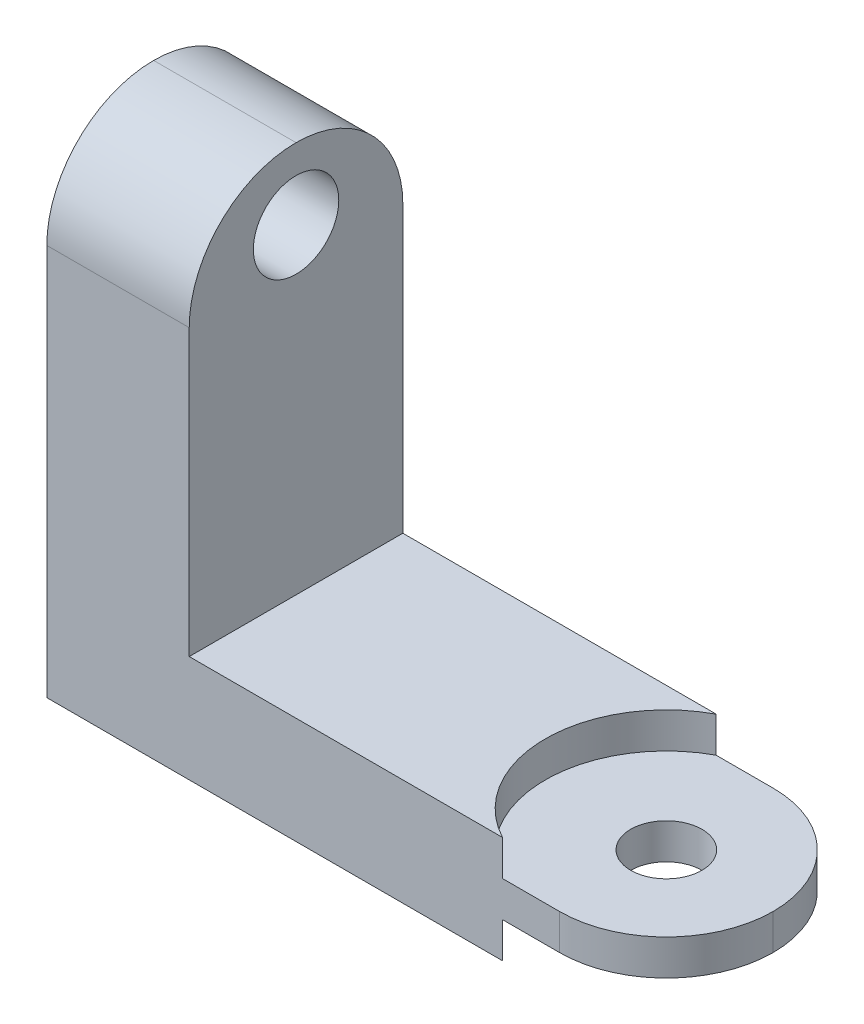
SolidWorks part; units mm, degrees
ref_plane "Plan 1" through (0, 0, 0) normal (0, 0, 1) x (1, 0, 0)
ref_plane "Plan 2" through (0, 0, 0) normal (0, 1, 0) x (1, 0, 0)
ref_plane "Plan 3" through (0, 0, 0) normal (1, 0, 0) x (0, 0, -1)
sketch "Esquisse1" plane through (0, 0, 0) normal (0, 0, 1) x (1, 0, 0)
  line L0 (0, 0) -> (87, 0)
  line L1 (87, 0) -> (87, 15)
  line L2 (87, 15) -> (20, 15)
  line L3 (20, 15) -> (20, 70)
  line L4 (20, 70) -> (0, 70)
  line L5 (0, 70) -> (0, 0)
  dimension "D1" = 70
  dimension "D2" = 87
  dimension "D3" = 20
  dimension "D4" = 15
extrude "Base-Extrusion" add sketch "Esquisse1" along normal blind 30
fillet "Congé1" radius 15 4 edges at (87, 7.5, 30) (87, 15, 15) (87, 0, 15) (87, 7.5, 0)
sketch "Esquisse2" plane through (20, 0, 0) normal (1, 0, 0) x (0, 0, -1)
  line L0 (-15, 70) -> (-15, 50) construction
  line L1 (-30, 70) -> (0, 70) construction
  circle A0 centre (-15, 60) radius 6
  dimension "D1" = 12
  dimension "D2" = 10
extrude "Enlèv. mat.-Extru.1" cut sketch "Esquisse2" against normal through all
sketch "Esquisse3" plane through (0, 15, 0) normal (0, 1, 0) x (-1, 0, 0)
  circle A0 centre (-72, 15) radius 5
  arc A1 (-87, 15) -> (-72, 0) centre (-72, 15) ccw construction
  dimension "D1" = 10
extrude "Enlèv. mat.-Extru.3" cut sketch "Esquisse3" against normal through all
sketch "Esquisse4" plane through (0, 15, 0) normal (0, 1, 0) x (-1, 0, 0)
  circle A0 centre (-72, 15) radius 17
  dimension "D1" = 34
extrude "Enlèv. mat.-Extru.4" cut sketch "Esquisse4" against normal blind 5
sketch "Esquisse5" plane through (0, 0, 0) normal (0, -1, 0) x (1, 0, 0)
  circle A0 centre (72, 15) radius 17
  arc A1 (64, 30) -> (64, 0) centre (72, 15) ccw construction
extrude "Enlèv. mat.-Extru.5" cut sketch "Esquisse5" against normal blind 5
fillet "Congé2" radius 15 4 edges at (10, 70, 30) (10, 70, 0) (0, 70, 15) (20, 70, 15)
sketch "Esq_WRNL_Compact001" plane through (0, 0, 0) normal (0, 0, 1) x (1, 0, 0)
  line L0 (-1, -1) -> (-1, 71)
  line L1 (88, -1) -> (88, 71)
  line L2 (-1, -1) -> (88, -1)
  line L3 (-1, 71) -> (88, 71)
